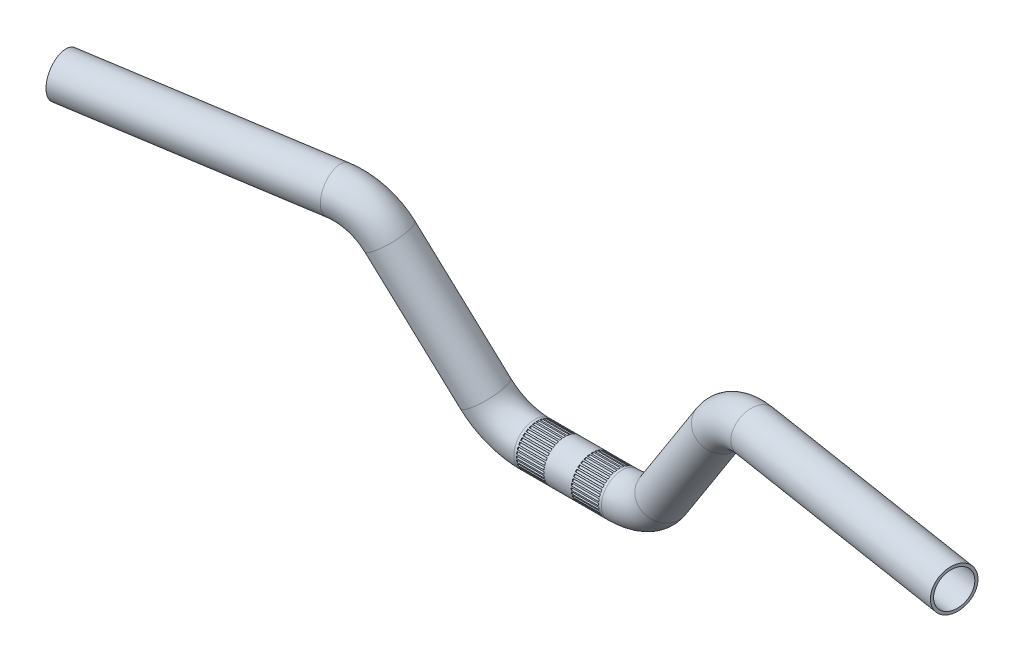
SolidWorks part; units mm, degrees
ref_plane "Front Plane" through (0, 0, 0) normal (0, 0, 1) x (1, 0, 0)
ref_plane "Top Plane" through (0, 0, 0) normal (0, 1, 0) x (1, 0, 0)
ref_plane "Right Plane" through (0, 0, 0) normal (1, 0, 0) x (0, 0, -1)
ref_plane "Plane1" through (0, 0, 25.4) normal (0, 0, 1) x (1, 0, 0)
ref_plane "Plane2" through (0, 0, 63.5) normal (0, 0, 1) x (1, 0, 0)
sketch "Sketch1" plane through (0, 0, 25.4) normal (0, 0, 1) x (1, 0, 0)
  point P0 (165, 140)
  dimension "D1" = 165
  dimension "D2" = 140
sketch "Sketch2" plane through (0, 0, 63.5) normal (0, 0, 1) x (1, 0, 0)
  point P0 (406.4, 140)
  dimension "D1" = 140
  dimension "D2" = 406.4
sketch3d "3DSketch1"
  line L0 (0, 0, 0) -> (39.911, 0, 0)
  line L1 (80.9592, 21.1063, 3.8293) -> (150.4327, 119.3914, 21.661)
  line L2 (190.2008, 140, 29.3774) -> (406.4, 140, 63.5)
  arc A0 (150.4327, 119.3914, 21.661) -> (190.2008, 140, 29.3774) centre (190.7375, 90.1186, 25.9771) ccw
  arc A1 (39.911, 0, 0) -> (80.9592, 21.1063, 3.8293) centre (39.911, 49.1969, 8.9257) ccw
  point P12 (165, 140, 25.4)
  point P13 (198.5139, 93.561, -23.2943)
  point P16 (66.04, 0, 0)
  point P17 (39.911, 40.2711, 58.1226)
  dimension "D1" = 50
  dimension "D2" = 66.04
sketch "Sketch3" plane through (0, 0, 0) normal (1, 0, 0) x (0, 0, -1)
  circle A0 centre (0, 0) radius 19
  dimension "D1" = 38
sweep "Sweep-Thin1" add profiles "Sketch3" path "3DSketch1" parameters "D1"=2.54
mirror "Mirror1" about plane through (0, 0, 0) normal (1, 0, 0) of "Sweep-Thin1"
sketch "Sketch4" plane through (0, 0, 0) normal (1, 0, 0) x (0, 0, -1)
  line L0 (0, 0) -> (0, -25.6563) construction
  circle A0 centre (0, -19) radius 1
  dimension "D1" = 2
  dimension "D2" = 19
extrude "Cut-Extrude1" cut sketch "Sketch4" against normal blind 25 from offset 12.5
pattern_circular "CirPattern1" count 36 over 360 about axis through (0, 0, 0) along (1, 0, 0) of "Cut-Extrude1"
mirror "Mirror2" about plane through (0, 0, 0) normal (1, 0, 0) of "CirPattern1", "Cut-Extrude1"
